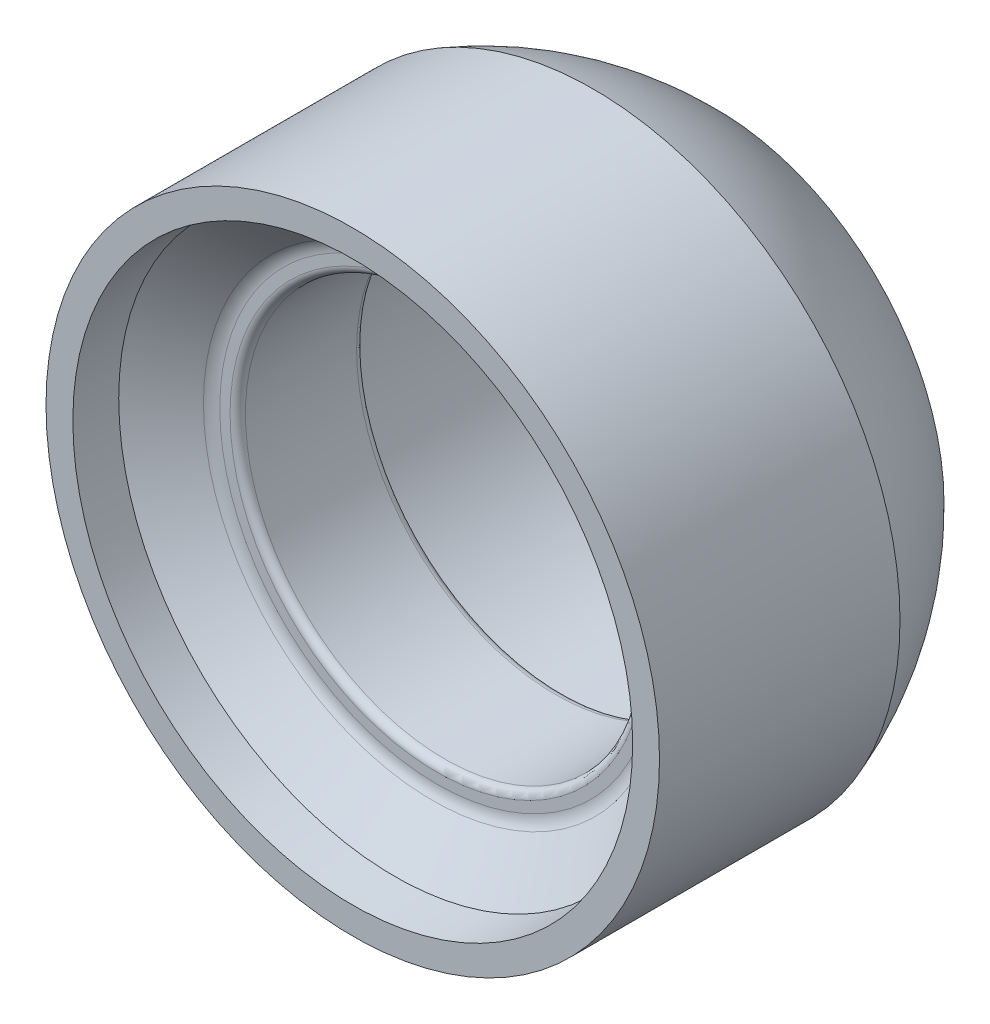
SolidWorks part; units mm, degrees
ref_plane "Ebene vorne" through (0, 0, 0) normal (0, 0, 1) x (1, 0, 0)
ref_plane "Ebene oben" through (0, 0, 0) normal (0, 1, 0) x (1, 0, 0)
ref_plane "Ebene rechts" through (0, 0, 0) normal (1, 0, 0) x (0, 0, -1)
sketch "Skizze1" plane through (0, 0, 0) normal (0, 1, 0) x (1, 0, 0)
  line L0 (0, 0) -> (0, 11.0998) construction
  line L1 (7.3, 0) -> (8, 0)
  line L2 (8, 0) -> (8, 6.2723)
  line L3 (7.3, 0) -> (7.2038, 1.1)
  line L4 (7.2038, 1.1) -> (5.8454, 2.2)
  line L5 (5.8454, 2.2) -> (5.2, 2.2)
  line L6 (5.2, 2.2) -> (5.2, 5.5)
  line L7 (5.2, 5.5) -> (5.75, 5.5)
  line L8 (5.9195, 9.5) -> (5.75, 9.5)
  line L9 (5.75, 9.5) -> (5.75, 5.5)
  arc A0 (8, 6.2723) -> (5.9195, 9.5) centre (0, 3.4) ccw
  dimension "D11" = 8.5
  dimension "D1" = 16
  dimension "D2" = 14.6
  dimension "D3" = 5
  dimension "D4" = 1.1
  dimension "D5" = 10.4
  dimension "D6" = 2.2
  dimension "D7" = 39
  dimension "D8" = 4
  dimension "D9" = 9.5
  dimension "D10" = 3.4
  dimension "D12" = 11.5
  dimension "D13" = 6.2723
revolve "Rotation1" add sketch "Skizze1" angle 360 about L0
fillet "Verrundung1" radius 0.2 3 edges at (5.2, 0, -5.5) (5.2, 0, -2.2) (5.75, 0, -5.5)
fillet "Verrundung2" radius 0.5 1 edges at (5.8454, 0, -2.2)
